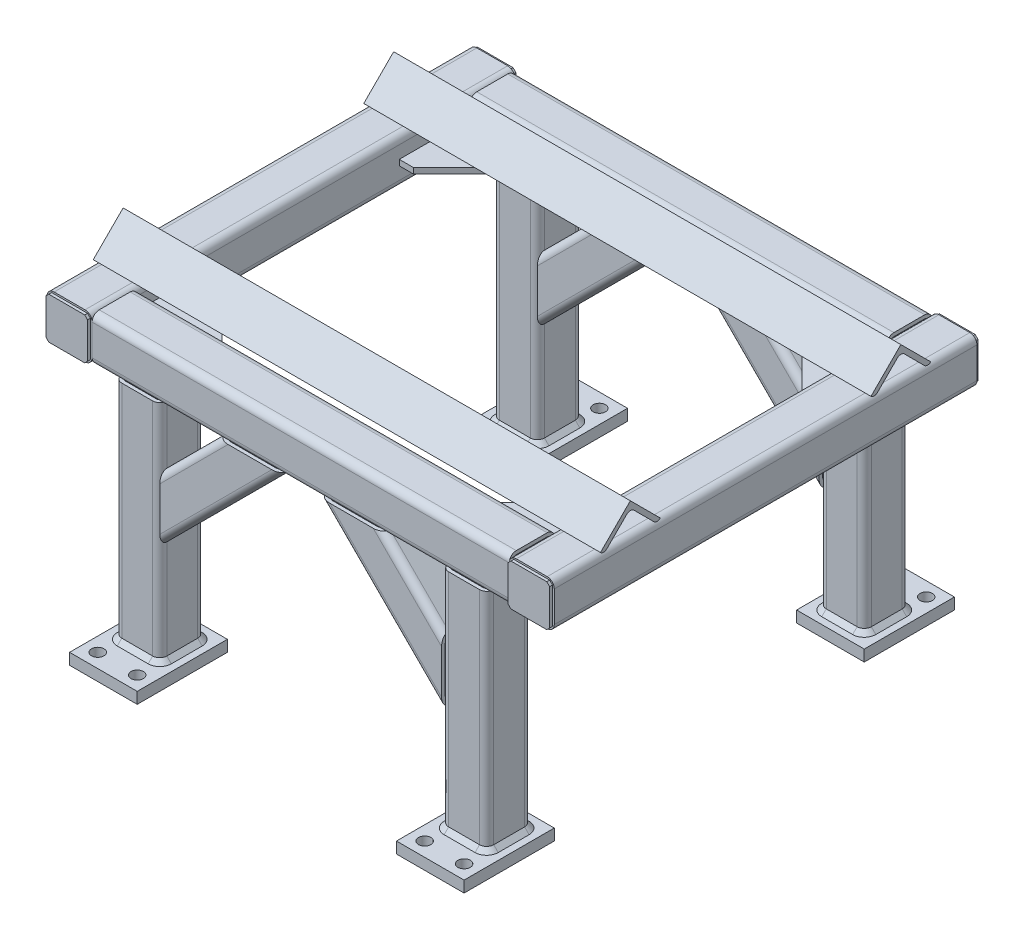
SolidWorks part; units mm, degrees
other "DetailItem1"
other "DetailItem13"
other "DetailItem2"
other "DetailItem3"
other "DetailItem4"
other "DetailItem5"
other "DetailItem6"
other "DetailItem7"
other "DetailItem8"
other "DetailItem9"
other "DetailItem10"
other "DetailItem11"
other "DetailItem12"
other "Weld Folder"
other "Weld Bead1"
other "Weld Bead2"
other "Weld Bead3"
other "Weld Bead4"
other "Weld Bead5"
other "Weld Bead6"
other "Weld Bead7"
other "Weld Bead12"
other "Weld Bead8"
other "Weld Bead9"
ref_plane "Default Plane" through (350, 20, -275) normal (0, -1, 0) x (-1, 0, 0)
sketch3d "Bounding-Box_BASE PLATES"
  line L0 (120, 0, 0) -> (120, 160, 0) construction
  line L1 (120, 160, 0) -> (0, 160, 0) construction
  line L2 (0, 160, 0) -> (0, 0, 0) construction
  line L3 (0, 0, 0) -> (120, 0, 0) construction
  line L4 (120, 0, 20) -> (120, 160, 20) construction
  line L5 (120, 160, 20) -> (0, 160, 20) construction
  line L6 (0, 160, 20) -> (0, 0, 20) construction
  line L7 (0, 0, 20) -> (120, 0, 20) construction
  line L8 (120, 0, 0) -> (120, 0, 20) construction
  line L9 (120, 160, 0) -> (120, 160, 20) construction
  line L10 (0, 160, 0) -> (0, 160, 20) construction
  line L11 (0, 0, 0) -> (0, 0, 20) construction
ref_plane "Default Plane" through (370, 455, -270) normal (0, 1, 0) x (1, 0, 0)
sketch3d "Bounding-Box_GUSSETS"
  line L0 (-125, 25, 0) -> (-125, -100, 0) construction
  line L1 (-125, -100, 0) -> (0, -100, 0) construction
  line L2 (0, -100, 0) -> (0, 25, 0) construction
  line L3 (0, 25, 0) -> (-125, 25, 0) construction
  line L4 (-125, 25, 10) -> (-125, -100, 10) construction
  line L5 (-125, -100, 10) -> (0, -100, 10) construction
  line L6 (0, -100, 10) -> (0, 25, 10) construction
  line L7 (0, 25, 10) -> (-125, 25, 10) construction
  line L8 (-125, 25, 0) -> (-125, 25, 10) construction
  line L9 (-125, -100, 0) -> (-125, -100, 10) construction
  line L10 (0, -100, 0) -> (0, -100, 10) construction
  line L11 (0, 25, 0) -> (0, 25, 10) construction
ref_plane "Default Plane" through (446.85, 491.85, -380) normal (0, 0, 1) x (1, 0, 0)
sketch3d "Bounding-Box_END CAPS"
  line L0 (-73.7, -68.7, 0) -> (0, -68.7, 0) construction
  line L1 (0, -68.7, 0) -> (0, 5, 0) construction
  line L2 (0, 5, 0) -> (-73.7, 5, 0) construction
  line L3 (-73.7, 5, 0) -> (-73.7, -68.7, 0) construction
  line L4 (-73.7, -68.7, 5) -> (0, -68.7, 5) construction
  line L5 (0, -68.7, 5) -> (0, 5, 5) construction
  line L6 (0, 5, 5) -> (-73.7, 5, 5) construction
  line L7 (-73.7, 5, 5) -> (-73.7, -68.7, 5) construction
  line L8 (-73.7, -68.7, 0) -> (-73.7, -68.7, 5) construction
  line L9 (0, -68.7, 0) -> (0, -68.7, 5) construction
  line L10 (0, 5, 0) -> (0, 5, 5) construction
  line L11 (-73.7, 5, 0) -> (-73.7, 5, 5) construction
ref_plane "Front Plane" through (0, 0, 0) normal (0, 0, 1) x (1, 0, 0)
ref_plane "Top Plane" through (0, 0, 0) normal (0, 1, 0) x (1, 0, 0)
ref_plane "Right Plane" through (0, 0, 0) normal (1, 0, 0) x (0, 0, -1)
ref_plane "Top of Frame" through (0, 500, 0) normal (0, 1, 0) x (1, 0, 0)
ref_plane "Bottom of Legs" through (0, 20, 0) normal (0, 1, 0) x (1, 0, 0)
sketch "Upper Frame" plane through (0, 500, 0) normal (0, 1, 0) x (1, 0, 0)
  line L0 (-450, 375) -> (450, -375) construction
  line L1 (450, 375) -> (-450, 375)
  line L2 (450, 375) -> (450, -375)
  line L3 (450, -375) -> (-450, -375)
  line L4 (-450, 375) -> (-450, -375)
  dimension "D1" = 900
  dimension "D2" = 750
ref_plane "Front of Frame" through (0, 0, 375) normal (0, 0, 1) x (1, 0, 0)
sketch "Leg Sketch" plane through (0, 0, 375) normal (0, 0, 1) x (1, 0, 0)
  line L0 (-290, 20) -> (-290, 500)
  line L1 (0, 429.9862) -> (0, 0) construction
  line L2 (-290, 220) -> (-10, 500)
  line L3 (450, 500) -> (-450, 500) construction
  line L4 (50, 20) -> (-50, 20) construction
  dimension "D1" = 200
  dimension "D2" = 45
  dimension "D3" = 580
other "Tube (square) 80 X 80 X 6.3(1)"
ref_plane "Plane2" through (410, 460, -375) normal (0, 0, 1) x (1, 0, 0)
sketch "Sketch1" plane through (410, 460, -375) normal (0, 0, 1) x (1, 0, 0)
  line L0 (-27.4, -33.7) -> (27.4, -33.7)
  line L1 (-33.7, -27.4) -> (-33.7, 27.4)
  line L2 (27.4, 33.7) -> (-27.4, 33.7)
  line L3 (33.7, 27.4) -> (33.7, -27.4)
  line L4 (-27.4, -40) -> (27.4, -40)
  line L5 (-40, -27.4) -> (-40, 27.4)
  line L6 (27.4, 40) -> (-27.4, 40)
  line L7 (40, 27.4) -> (40, -27.4)
  line L8 (-40, 0) -> (-33.7, 0) construction
  line L9 (-33.7, 0) -> (33.7, 0) construction
  line L10 (33.7, 0) -> (40, 0) construction
  line L12 (0, 40) -> (0, 33.7) construction
  line L13 (0, 33.7) -> (0, -33.7) construction
  line L14 (0, -33.7) -> (0, -40) construction
  arc A0 (40, 27.4) -> (27.4, 40) centre (27.4, 27.4) ccw
  arc A1 (27.4, -40) -> (40, -27.4) centre (27.4, -27.4) ccw
  arc A2 (-40, -27.4) -> (-27.4, -40) centre (-27.4, -27.4) ccw
  arc A3 (-27.4, 40) -> (-40, 27.4) centre (-27.4, 27.4) ccw
  arc A4 (-27.4, 33.7) -> (-33.7, 27.4) centre (-27.4, 27.4) ccw
  arc A5 (33.7, 27.4) -> (27.4, 33.7) centre (27.4, 27.4) ccw
  arc A6 (27.4, -33.7) -> (33.7, -27.4) centre (27.4, -27.4) ccw
  arc A7 (-33.7, -27.4) -> (-27.4, -33.7) centre (-27.4, -27.4) ccw
  point P2 (-40, 40)
  point P33 (-40, -40)
  point P34 (40, -40)
  point P36 (40, 40)
  point P37 (0, 0)
  dimension "D1" = 12.6
  dimension "Thickness" = 6.3
  dimension "V_leg" = 80
  dimension "H_leg" = 80
sketch "Sketch2" plane through (0, 20, 0) normal (0, 1, 0) x (1, 0, 0)
  line L0 (-290, -375) -> (-290, -435) construction
  line L1 (-350, -435) -> (-230, -435)
  line L2 (-350, -435) -> (-350, -275)
  line L3 (-350, -275) -> (-230, -275)
  line L4 (-230, -435) -> (-230, -275)
  dimension "D1" = 120
  dimension "D2" = 160
  dimension "D3" = 60
extrude "Boss-Extrude1" add sketch "Sketch2" against normal blind 20 separate body
hole_wizard "M20 Clearance Hole1" positions "Sketch3" profile "Sketch4" hole size "M20" standard "ANSI Metric"
sketch "Sketch3" plane through (0, 20, 0) normal (0, 1, 0) x (1, 0, 0)
  line L0 (-325, -410) -> (-255, -410) construction
  line L3 (-290, -375) -> (-290, -410) construction
  line L4 (-317.4, -375) -> (-262.6, -375) construction
  line L6 (-350, -435) -> (-230, -435) construction
  point P0 (-325, -410)
  point P2 (-255, -410)
  dimension "D1" = 25
  dimension "D2" = 70
sketch "Sketch4" plane through (-325, 20, 410) normal (1, 0, 0) x (0, 0, 1)
  line L0 (0, 0) -> (0, 20)
  line L1 (0, 20) -> (11, 20)
  line L2 (11, 20) -> (11, 0)
  line L5 (11, 0) -> (0, 0)
  line L11 (0, -6.35) -> (0, 107.95) construction
  dimension "Thru Hole Dia." = 22
  dimension "Thru Hole Depth" = 20
other "Gusset1" parameters "D1"=10, "D2"=10, "D3"=0, "D4"=0, "D10"=5, "D11"=125, "D12"=125, "D13"=25, "D14"=45, "D15"=25, "D16"=25, "D17"=25, "D18"=45
sketch "Sketch5" plane through (-370, 460, 295) normal (0, 1, 0) x (1, 0, 0)
  line L0 (0, 25) -> (0, 125)
  line L1 (25, 0) -> (125, 0)
  line L2 (0, 25) -> (25, 0)
  line L3 (25, 125) -> (125, 25)
  line L4 (0, 125) -> (25, 125)
  line L5 (125, 0) -> (125, 25)
other "End cap1" parameters "D1"=5, "D2"=3, "D3"=5
other "Fillet Bead1" parameters "D10"=6, "D11"=8, "D12"=0, "D13"=3, "D14"=0
mirror "Mirror1" about plane through (0, 0, 0) normal (1, 0, 0)
sketch "Rails Sketch" plane through (0, 500, 0) normal (0, 1, 0) x (1, 0, 0)
  line L0 (-450, 0) -> (450, 0) construction
  line L1 (-450, 375) -> (-450, -375) construction
  line L2 (450, -375) -> (450, 375) construction
  line L3 (-450, -240) -> (450, -240)
  line L4 (-450, 240) -> (450, 240)
  line L5 (-450, 375) -> (-450, -375) construction
  dimension "D1" = 480
other "L angle (equal) MODIFIED_75X75X8(1)"
ref_plane "Plane4" through (-450, 555.3762, 240) normal (1, 0, 0) x (0, -0.7071, 0.7071)
sketch "Sketch12" plane through (-450, 555.3762, 240) normal (1, 0, 0) x (0, -0.7071, 0.7071)
  line L0 (0, 75) -> (0, 0)
  line L1 (5.6569, 72.6569) -> (72.6569, 5.6569) construction
  line L2 (8, 67) -> (8, 17)
  line L3 (17, 8) -> (67, 8)
  line L5 (75, 0) -> (0, 0)
  arc A0 (8, 67) -> (0, 75) centre (0, 67) ccw
  arc A1 (75, 0) -> (67, 8) centre (67, 0) ccw
  arc A2 (17, 8) -> (8, 17) centre (17, 17) cw
  point P8 (0, 37.5)
  point P9 (37.5, 0)
  point P11 (39.1569, 39.1569)
  point P16 (0, 0)
  dimension "Radius_2" = 8
  dimension "Radius_1" = 9
  dimension "V_leg" = 75
  dimension "H_leg" = 75
  dimension "thickness" = 8
sketch "Sketch13" plane through (0, 0, 0) normal (0, 0, 1) x (1, 0, 0)
  line L0 (-350, 5) -> (350, 5)
  line L1 (-350, 0) -> (-350, 20) construction
  line L2 (350, 0) -> (350, 20) construction
  line L3 (437.4, 500) -> (382.6, 500) construction
  dimension "D1" = 495
